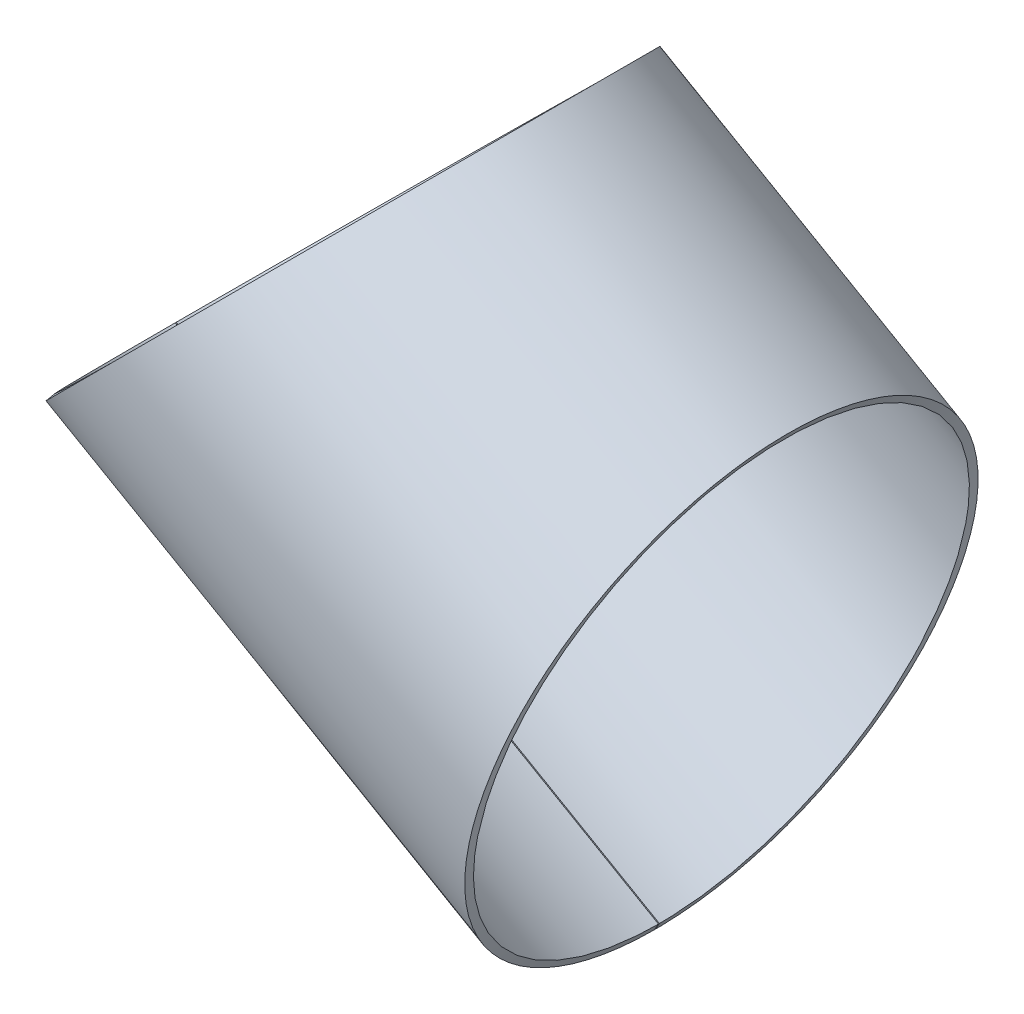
SolidWorks part; units mm, degrees
ref_plane "前视基准面" through (0, 0, 0) normal (0, 0, 1) x (1, 0, 0)
ref_plane "上视基准面" through (0, 0, 0) normal (0, 1, 0) x (1, 0, 0)
ref_plane "右视基准面" through (0, 0, 0) normal (1, 0, 0) x (0, 0, -1)
imported_body "基体零件-人字形三通管-1"
sheet metal parameters "钣金1" parameters "D1"=0.7366, "厚度"=8
bend "圆角折弯1" bend radius 242 bend angle 359.771 parameters "D5"=1
flatten bends "展开-折弯1"
sketch "尖角-草图1" plane through (275.0003, -909.3262, 0.5) normal (-0.5, -0.866, 0.002) x (0.866, -0.5, 0.0012)
  line L0 (-280.469, 760.1058) -> (282.2236, 759.456) construction
  dimension "D1" = 0
process bends "加工-折弯1" parameters "D1"=0
sketch "平面-草图1" plane through (275.0003, -909.3262, 0.5) normal (-0.5, -0.866, 0.002) x (0.866, -0.5, 0.0012)
